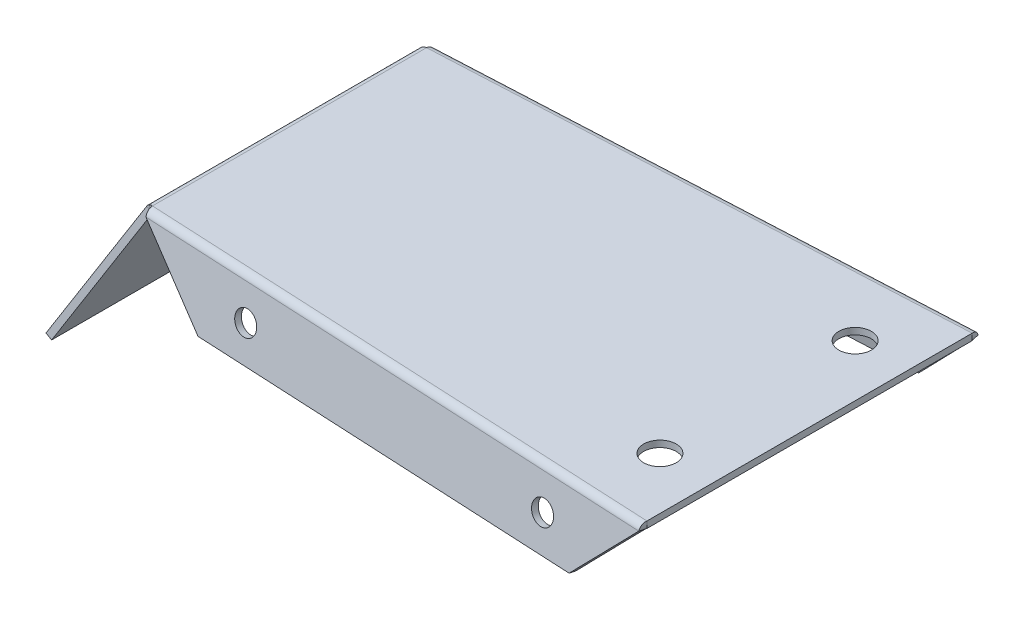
SolidWorks part; units mm, degrees
ref_plane "Front Plane" through (0, 0, 0) normal (0, 0, 1) x (1, 0, 0)
ref_plane "Top Plane" through (0, 0, 0) normal (0, 1, 0) x (1, 0, 0)
ref_plane "Right Plane" through (0, 0, 0) normal (1, 0, 0) x (0, 0, -1)
sketch "Sketch1" plane through (0, 0, 0) normal (0, 1, 0) x (1, 0, 0)
  line L0 (0, 0) -> (105, 0) construction
  line L1 (0, -24) -> (0, 24)
  line L2 (0, 24) -> (25, 21)
  line L3 (25, 21) -> (35, 31.5125)
  line L4 (35, 31.5125) -> (95, 34.5125)
  line L5 (95, 34.5125) -> (105, 25)
  line L6 (105, 25) -> (105, -25)
  line L7 (25, 21) -> (105, 25) construction
  line L8 (25, 21) -> (25, -21) construction
  line L9 (36.288, 26.5706) -> (92.2191, 29.3672) construction
  line L10 (36.288, -26.5706) -> (92.2191, -29.3672) construction
  line L11 (25, -21) -> (105, -25) construction
  line L12 (95, -34.5125) -> (105, -25)
  line L13 (35, -31.5125) -> (95, -34.5125)
  line L14 (25, -21) -> (35, -31.5125)
  line L15 (0, -24) -> (25, -21)
  circle A0 centre (42, 26.8562) radius 1.75
  circle A1 centre (90, 29.2562) radius 1.75
  circle A2 centre (97, 15) radius 2.5
  circle A3 centre (97, -15) radius 2.5
  circle A4 centre (90, -29.2562) radius 1.75
  circle A5 centre (42, -26.8562) radius 1.75
  point P20 (25, 0)
  dimension "D10" = 3.5
  dimension "D11" = 48
  dimension "D12" = 15
  dimension "D13" = 5
  dimension "D14" = 8
  dimension "D15" = 15
  dimension "D1" = 24
  dimension "D2" = 25
  dimension "D3" = 10
  dimension "D4" = 21
  dimension "D5" = 25
  dimension "D6" = 10
  dimension "D7" = 80
  dimension "D8" = 10
  dimension "D9" = 5
sheet metal parameters "Sheet-Metal1" thickness 1 parameters "D1"=1
base flange "Base-Flange1" sketch "Sketch1" thickness 1 reverse thickness direction no parameters "D1"=1
sketch "Sketch3" plane through (0, 0, 0) normal (0, 1, 0) x (1, 0, 0)
  line L0 (25, 21) -> (25, -21)
sketched bend "Sketched Bend5" parameters "D1"=0.1
bend "SketchBend5" bend radius 0.1 bend angle 60 parameters "D5"=1
sketch "Sketch4" plane through (0, 0, 0) normal (0, 1, 0) x (1, 0, 0)
  line L0 (25.0577, 21.0607) -> (105, 25)
  line L1 (25.0577, -21.0607) -> (105, -25)
sketched bend "Sketched Bend8" parameters "D1"=0.1
bend "SketchBend8" bend radius 0.1 bend angle 80 parameters "D5"=2
bend "SketchBend9" bend radius 0.1 bend angle 80 parameters "D5"=3
flat pattern "Flat-Pattern1"
sketch "Bend-Lines1" plane through (0, 0, 0) normal (0, 1, 0) x (-1, 0, 0)
bend of the flat pattern "Flatten-<SketchBend5>1"
bend of the flat pattern "Flatten-<SketchBend8>1"
bend of the flat pattern "Flatten-<SketchBend9>1"
